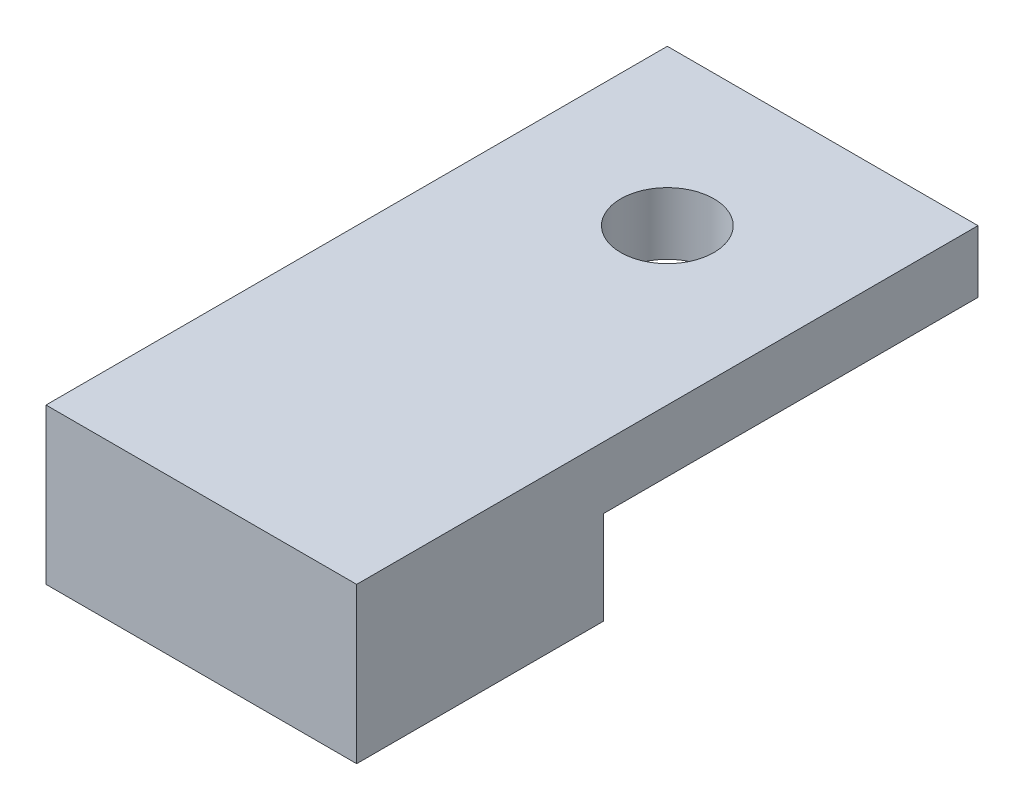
SolidWorks part; units mm, degrees
ref_plane "Plan de face" through (0, 0, 0) normal (0, 0, 1) x (1, 0, 0)
ref_plane "Plan de dessus" through (0, 0, 0) normal (0, 1, 0) x (1, 0, 0)
ref_plane "Plan de droite" through (0, 0, 0) normal (1, 0, 0) x (0, 0, -1)
sketch "Esquisse3" plane through (0, 0, 0) normal (1, 0, 0) x (0, 0, -1)
  line L0 (0, 0) -> (0, 5)
  line L1 (0, 5) -> (20, 5)
  line L2 (20, 5) -> (20, 3)
  line L3 (20, 3) -> (7.95, 3)
  line L4 (7.95, 3) -> (7.95, 0)
  line L5 (7.95, 0) -> (0, 0)
  dimension "D1" = 5
  dimension "D2" = 20
  dimension "D3" = 3
  dimension "D4" = 7.95
extrude "Boss.-Extru.2" add sketch "Esquisse3" along normal blind 10
sketch "Esquisse4" plane through (0, 5, 0) normal (0, 1, 0) x (1, 0, 0)
  line L0 (10, 20) -> (0, 20) construction
  circle A0 centre (5, 15) radius 1.5
  dimension "D1" = 3
  dimension "D2" = 5
extrude "Enlèv. mat.-Extru.2" cut sketch "Esquisse4" against normal blind 10
